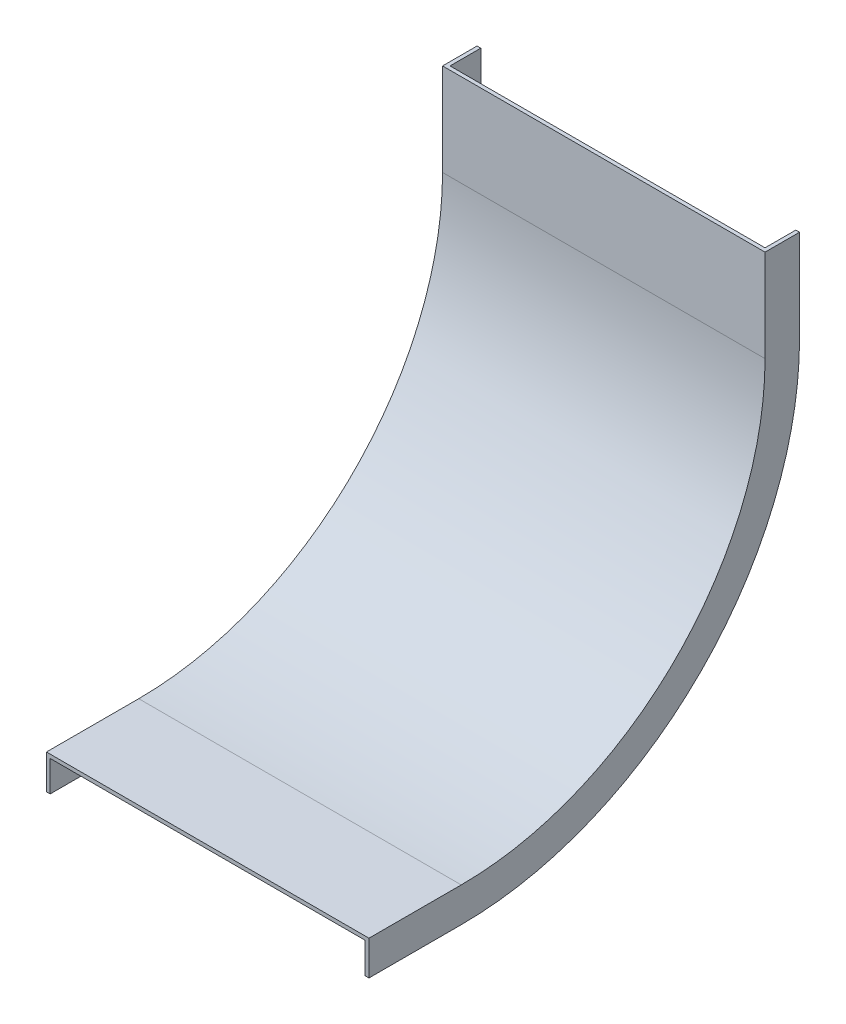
SolidWorks part; units mm, degrees
ref_plane "Front Plane" through (0, 0, 0) normal (0, 0, 1) x (1, 0, 0)
ref_plane "Top Plane" through (0, 0, 0) normal (0, 1, 0) x (1, 0, 0)
ref_plane "Right Plane" through (0, 0, 0) normal (1, 0, 0) x (0, 0, -1)
sketch "Sketch1" plane through (0, 0, 0) normal (1, 0, 0) x (0, 0, -1)
  line L0 (0, 0) -> (30, 0)
  line L1 (130, 100) -> (130, 130)
  arc A0 (30, 0) -> (130, 100) centre (30, 100) ccw
  dimension "D2" = 100
  dimension "D1" = 30
sketch "Sketch2" plane through (0, 0, 0) normal (0, 0, 1) x (1, 0, 0)
  line L0 (0, -10) -> (0, 0)
  line L1 (0, 0) -> (0, 100) construction
  line L2 (0, 0) -> (-102.428, 0)
  line L3 (-102.428, 0) -> (-102.428, -10)
  line L4 (1.214, -10) -> (1.214, 1.214)
  line L5 (1.214, 1.214) -> (-103.642, 1.214)
  line L6 (-103.642, 1.214) -> (-103.642, -10)
  line L7 (-102.428, -10) -> (-103.642, -10)
  line L8 (-103.642, 1.214) -> (-103.642, -10.8764) construction
  line L10 (0, -10) -> (1.214, -10)
  line L12 (1.214, -12.3785) -> (1.214, 1.214) construction
  arc A1 (1.214, -12.3785) -> (1.0568, -12.1644) centre (-1.4069, -14.1383) ccw construction
  arc A4 (0, -10) -> (2.0042, -11.4053) centre (-1.4069, -14.1383) ccw construction
  arc A5 (-102.428, -10) -> (-106.5745, -18.1923) centre (-104.3149, -14.1904) cw construction
  arc A8 (-103.642, -10.8764) -> (-105.9776, -17.1351) centre (-104.3149, -14.1904) cw construction
  dimension "D2" = 10
  dimension "D1" = 102.428
  dimension "D4" = 1.214
sweep "Sweep1" add profiles "Sketch2" path "Sketch1"
